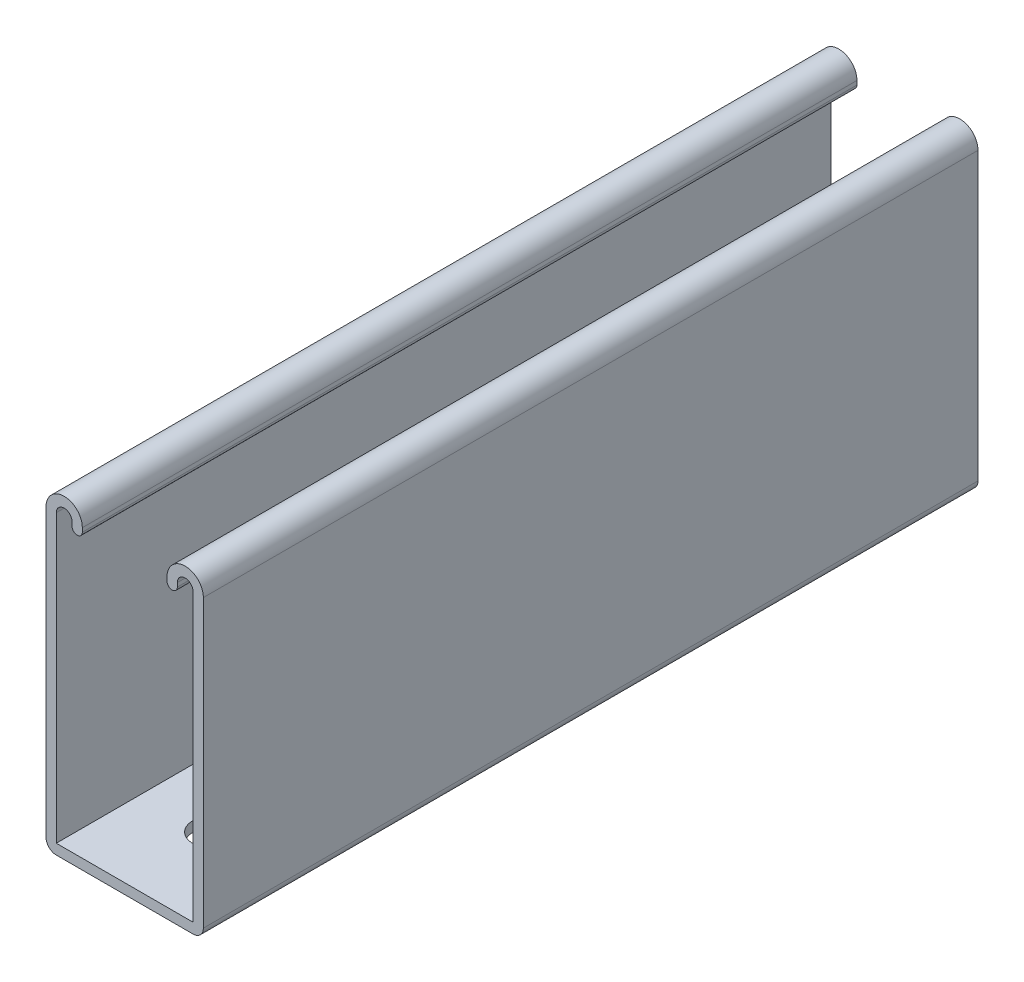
SolidWorks part; units mm, degrees
ref_plane "Plane1" through (0, 0, 0) normal (0, 0, 1) x (1, 0, 0)
ref_plane "Plane2" through (0, 0, 0) normal (0, 1, 0) x (1, 0, 0)
ref_plane "Plane3" through (0, 0, 0) normal (1, 0, 0) x (0, 0, -1)
sketch "Sketch1" plane through (0, 0, 0) normal (0, 0, 1) x (1, 0, 0)
  line L0 (-20.6375, 39.6875) -> (-20.6375, -35.4076)
  line L1 (-17.9451, -38.1) -> (17.9451, -38.1)
  line L2 (20.6375, -35.4076) -> (20.6375, 39.6875)
  line L3 (11.1125, 39.6875) -> (11.1125, 38.6524)
  line L4 (-11.1125, 39.6875) -> (-11.1125, 38.6524)
  line L5 (-13.8049, 39.6875) -> (-13.8049, 38.6524)
  line L6 (-17.9451, 39.6875) -> (-17.9451, -35.4076)
  line L7 (-17.9451, -35.4076) -> (17.9451, -35.4076)
  line L8 (17.9451, -35.4076) -> (17.9451, 39.6875)
  line L9 (13.8049, 39.6875) -> (13.8049, 38.6524)
  line L10 (-25.4, 44.45) -> (25.4, 44.45) construction
  line L11 (-12.8524, 37.3062) -> (12.8524, 37.3062) construction
  arc A0 (20.6375, 39.6875) -> (11.1125, 39.6875) centre (15.875, 39.6875) ccw
  arc A1 (-20.6375, 39.6875) -> (-11.1125, 39.6875) centre (-15.875, 39.6875) cw
  arc A2 (-17.9451, -38.1) -> (-20.6375, -35.4076) centre (-17.9451, -35.4076) cw
  arc A3 (17.9451, -38.1) -> (20.6375, -35.4076) centre (17.9451, -35.4076) ccw
  arc A4 (-17.9451, 39.6875) -> (-13.8049, 39.6875) centre (-15.875, 39.6875) cw
  arc A5 (17.9451, 39.6875) -> (13.8049, 39.6875) centre (15.875, 39.6875) ccw
  arc A6 (11.1125, 38.6524) -> (13.8049, 38.6524) centre (12.4587, 38.6524) ccw
  arc A7 (-11.1125, 38.6524) -> (-13.8049, 38.6524) centre (-12.4587, 38.6524) cw
  dimension "D1" = 2.6924
  dimension "D3" = 20.6375
  dimension "Width" = 41.275
  dimension "D5" = 38.1
  dimension "D6" = 9.525
  dimension "D7" = 22.225
  dimension "D8" = 44.45
  dimension "D9" = 7.1437
  dimension "gauge" = 2.6924
extrude "Base-Extrude" add sketch "Sketch1" along normal blind 203.2
extrude "Slot" cut sketch "Sketch2" against normal through all
sketch "Sketch2" plane through (-0.5607, -38.1, -14.6683) normal (0, -1, 0) x (1, 0, 0)
  line L0 (5.7201, 93.2496) -> (5.7201, 27.3683)
  line L1 (-4.5987, 27.3683) -> (-4.5987, 93.2496)
  arc A0 (-4.5987, 27.3683) -> (5.7201, 27.3683) centre (0.5607, 27.3683) ccw
  arc A1 (5.7201, 93.2496) -> (-4.5987, 93.2496) centre (0.5607, 93.2496) ccw
  dimension "D3" = 10.3187
  dimension "D1" = 12.7
  dimension "D2" = 65.8813
pattern_linear "LPattern1" count 2 spacing 101.6 along (0, 0, 1) of "Slot"
equation "\"D3@Sketch1\" = \"Width@Sketch1\" / 2"
equation "\"D7@Sketch1\" = \"Width@Sketch1\" - 2 * \"D6@Sketch1\""
equation "\"D1@Sketch1\" = \"gauge@Sketch1\""
equation "\"D1@LPattern1\" = \"D1@Base-Extrude\" / \"D3@LPattern1\""
